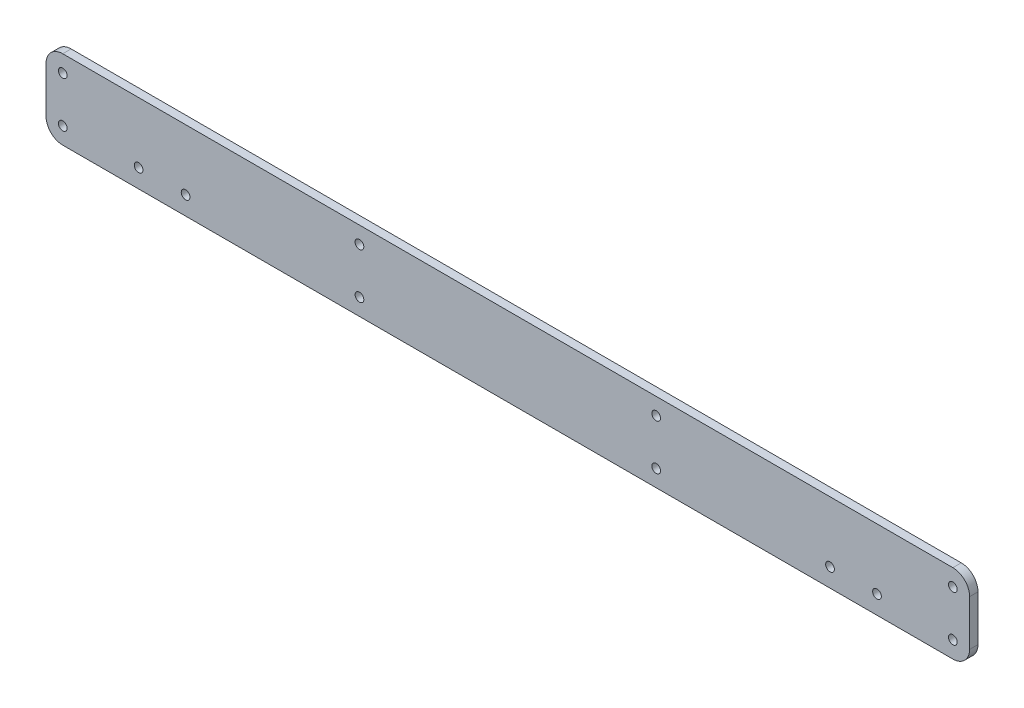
SolidWorks part; units mm, degrees
ref_plane "Front" through (0, 0, 0) normal (0, 0, 1) x (1, 0, 0)
ref_plane "Top" through (0, 0, 0) normal (0, 1, 0) x (1, 0, 0)
ref_plane "Right" through (0, 0, 0) normal (1, 0, 0) x (0, 0, -1)
sketch "Sketch1" plane through (0, 0, 0) normal (0, 0, 1) x (1, 0, 0)
  line L1 (-175, 30) -> (175, 30)
  line L2 (-175, 30) -> (-175, 0)
  line L3 (-175, 0) -> (175, 0)
  line L4 (175, 30) -> (175, 0)
  point P4 (0, 0)
  dimension "D1" = 30
  dimension "D2" = 350
base flange "Base-Flange1" sketch "Sketch1" thickness 3.175 reverse thickness direction no parameters "D1"=2.159
fillet "Fillet1" radius 6.35 4 edges at (-175, 0, -1.5875) (-175, 30, -1.5875) (175, 30, -1.5875) (175, 0, -1.5875)
hole_wizard "M4x0.7 Tapped Hole1" positions "Sketch8" profile "Sketch7" tap size "M4x0.7" standard "ANSI Metric"
sketch "Sketch8" plane through (0, 0, -3.175) normal (0, 0, -1) x (-1, 0, 0)
  point P0 (122.1, 7)
  point P3 (139.9, 7)
sketch "Sketch7" plane through (-122.1, 7, -3.175) normal (1, 0, 0) x (0, 1, 0)
  line L0 (0, 0) -> (0, 3.175)
  line L1 (0, 3.175) -> (1.65, 3.175)
  line L2 (1.65, 3.175) -> (1.65, 0)
  line L5 (1.65, 0) -> (0, 0)
  line L11 (0, -6.35) -> (0, 107.95) construction
  dimension "Thru Tap Drill Dia." = 3.3
  dimension "Thru Tap Drill Depth" = 3.175
mirror "Mirror1" about plane through (0, 0, 0) normal (1, 0, 0) of "M4x0.7 Tapped Hole1"
hole_wizard "M4x0.7 Tapped Hole2" positions "Sketch11" profile "Sketch10" tap size "M4x0.7" standard "ANSI Metric"
sketch "Sketch11" plane through (0, 0, -3.175) normal (0, 0, -1) x (-1, 0, 0)
  line L0 (-168.65, 23.65) -> (-56.2167, 23.65)
  line L1 (-56.2167, 23.65) -> (56.2167, 23.65)
  line L2 (56.2167, 23.65) -> (168.65, 23.65)
  line L4 (-168.65, 6.35) -> (-56.2167, 6.35)
  line L5 (-56.2167, 6.35) -> (56.2167, 6.35)
  line L6 (56.2167, 6.35) -> (168.65, 6.35)
sketch "Sketch10" plane through (168.65, 23.65, -3.175) normal (1, 0, 0) x (0, 1, 0)
  line L0 (0, 0) -> (0, 3.175)
  line L1 (0, 3.175) -> (1.65, 3.175)
  line L2 (1.65, 3.175) -> (1.65, 0)
  line L5 (1.65, 0) -> (0, 0)
  line L11 (0, -6.35) -> (0, 107.95) construction
  dimension "Thru Tap Drill Dia." = 3.3
  dimension "Thru Tap Drill Depth" = 3.175
sketch "Bend-Lines1" [suppressed] plane through (0, 0, 0) normal (0, 1, 0) x (1, 0, 0)
sketch "Bounding-Box1" [suppressed] plane through (0, 0, 0) normal (0, 1, 0) x (1, 0, 0)
sheet metal parameters "Sheet-Metal4" thickness 3.175 parameters "D1"=2.159
flat pattern "Flat-Pattern4"
sketch "Bend-Lines2" plane through (0, 0, 0) normal (0, 1, 0) x (1, 0, 0)
sketch3d "Bounding-Box2" [suppressed]
  line L0 (-175, 30, 0) -> (175, 30, 0) construction
  line L1 (-175, 0, 0) -> (175, 0, 0) construction
  line L2 (-175, 30, 0) -> (-175, 0, 0) construction
  line L3 (175, 30, 0) -> (175, 0, 0) construction
sheet metal parameters "Sheet-Metal5" thickness 3.175 parameters "D1"=2.159
flat pattern "Flat-Pattern4"
sketch "Bend-Lines2" plane through (0, 0, 0) normal (0, 1, 0) x (1, 0, 0)
sketch3d "Bounding-Box2" [suppressed]
  line L0 (-175, 30, 0) -> (175, 30, 0) construction
  line L1 (-175, 0, 0) -> (175, 0, 0) construction
  line L2 (-175, 30, 0) -> (-175, 0, 0) construction
  line L3 (175, 30, 0) -> (175, 0, 0) construction
sheet metal parameters "Sheet-Metal6" thickness 3.175 parameters "D1"=2.159
flat pattern "Flat-Pattern4"
sketch "Bend-Lines2" plane through (0, 0, 0) normal (0, 1, 0) x (1, 0, 0)
sketch3d "Bounding-Box2" [suppressed]
  line L0 (-175, 30, 0) -> (175, 30, 0) construction
  line L1 (-175, 0, 0) -> (175, 0, 0) construction
  line L2 (-175, 30, 0) -> (-175, 0, 0) construction
  line L3 (175, 30, 0) -> (175, 0, 0) construction
sheet metal parameters "Sheet-Metal7" thickness 3.175 parameters "D1"=2.159
flat pattern "Flat-Pattern4"
sketch "Bend-Lines2" plane through (0, 0, 0) normal (0, 1, 0) x (1, 0, 0)
sketch3d "Bounding-Box2" [suppressed]
  line L0 (-175, 30, 0) -> (175, 30, 0) construction
  line L1 (-175, 0, 0) -> (175, 0, 0) construction
  line L2 (-175, 30, 0) -> (-175, 0, 0) construction
  line L3 (175, 30, 0) -> (175, 0, 0) construction
